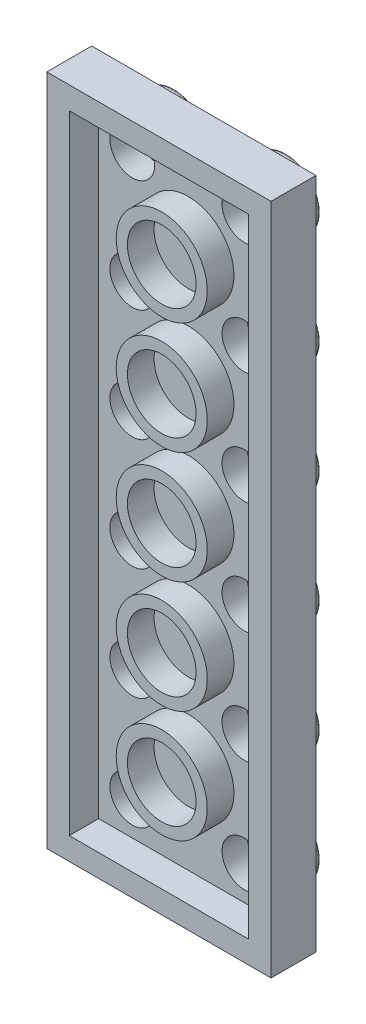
SolidWorks part; units mm, degrees
ref_plane "Vorne" through (0, 0, 0) normal (0, 0, 1) x (1, 0, 0)
ref_plane "Oben" through (0, 0, 0) normal (0, 1, 0) x (1, 0, 0)
ref_plane "Rechts" through (0, 0, 0) normal (1, 0, 0) x (0, 0, -1)
sketch "Skizze1" plane through (0, 0, 0) normal (0, 0, 1) x (1, 0, 0)
  line L1 (0, 0) -> (-16, 0)
  line L2 (0, 0) -> (0, -48)
  line L3 (0, -48) -> (-16, -48)
  line L4 (-16, 0) -> (-16, -48)
  dimension "D1" = 16
  dimension "D2" = 48
extrude "Linear austragen1" add sketch "Skizze1" along normal blind 3.2
sketch "Skizze2" plane through (0, 0, 3.2) normal (0, 0, 1) x (1, 0, 0)
  line L0 (-16, -48) -> (0, -48) construction
  line L1 (-1.6, -46.4) -> (-14.4, -46.4)
  line L2 (-1.6, -46.4) -> (-1.6, -1.6)
  line L3 (-1.6, -1.6) -> (-14.4, -1.6)
  line L4 (-14.4, -46.4) -> (-14.4, -1.6)
  line L5 (0, -48) -> (0, 0) construction
  line L6 (-16, 0) -> (-16, -48) construction
  line L7 (0, 0) -> (-16, 0) construction
  dimension "D1" = 1.6
  dimension "D2" = 1.6
  dimension "D3" = 1.6
  dimension "D4" = 1.6
extrude "Schnitt-Linear austragen1" cut sketch "Skizze2" against normal blind 2.1
sketch "Skizze3" plane through (0, 0, 1.1) normal (0, 0, 1) x (1, 0, 0)
  line L0 (0, -48) -> (0, 0) construction
  line L2 (0, 0) -> (-16, 0) construction
  circle A0 centre (-8, -8) radius 3.25
  circle A1 centre (-8, -8) radius 2.45
  dimension "D1" = 6.5
  dimension "D2" = 4.9
  dimension "D3" = 8
  dimension "D4" = 8
extrude "Linear austragen2" add sketch "Skizze3" along normal blind 1.9
sketch "Skizze4" plane through (0, 0, 0) normal (0, 0, -1) x (-1, 0, 0)
  line L0 (0, 0) -> (16, 0) construction
  line L1 (0, -48) -> (0, 0) construction
  circle A0 centre (4, -4) radius 2.45
  dimension "D1" = 4.9
  dimension "D2" = 4
  dimension "D3" = 4
extrude "Linear austragen3" add sketch "Skizze4" along normal blind 1.9
fillet "Verrundung1" radius 0.2 1 edges at (-6.45, -4, -1.9)
sketch "Skizze8" plane through (0, 0, -1.9) normal (0, 0, -1) x (-1, 0, 0)
  line L0 (4.5102, -5.6382) -> (4.746, -2.1452) construction
  text T0 "Lego  " font "SWIsop1" height in points 5
extrude "Linear austragen4" add sketch "Skizze8" along normal blind 0.2
pattern_linear "Lineares Muster2" count 5 spacing 8 along (0, -1, 0) of "Linear austragen2"
sketch "Skizze9" plane through (0, 0, 1.1) normal (0, 0, 1) x (1, 0, 0)
  circle A0 centre (-4, -4) radius 1.6
extrude "Schnitt-Linear austragen2" cut sketch "Skizze9" against normal blind 1.8
pattern_linear "Lineares Muster1" count 2 spacing 8 along (-1, 0, 0) count 6 spacing 8 along (0, -1, 0) of "Verrundung1", "Linear austragen3", "Schnitt-Linear austragen2"
